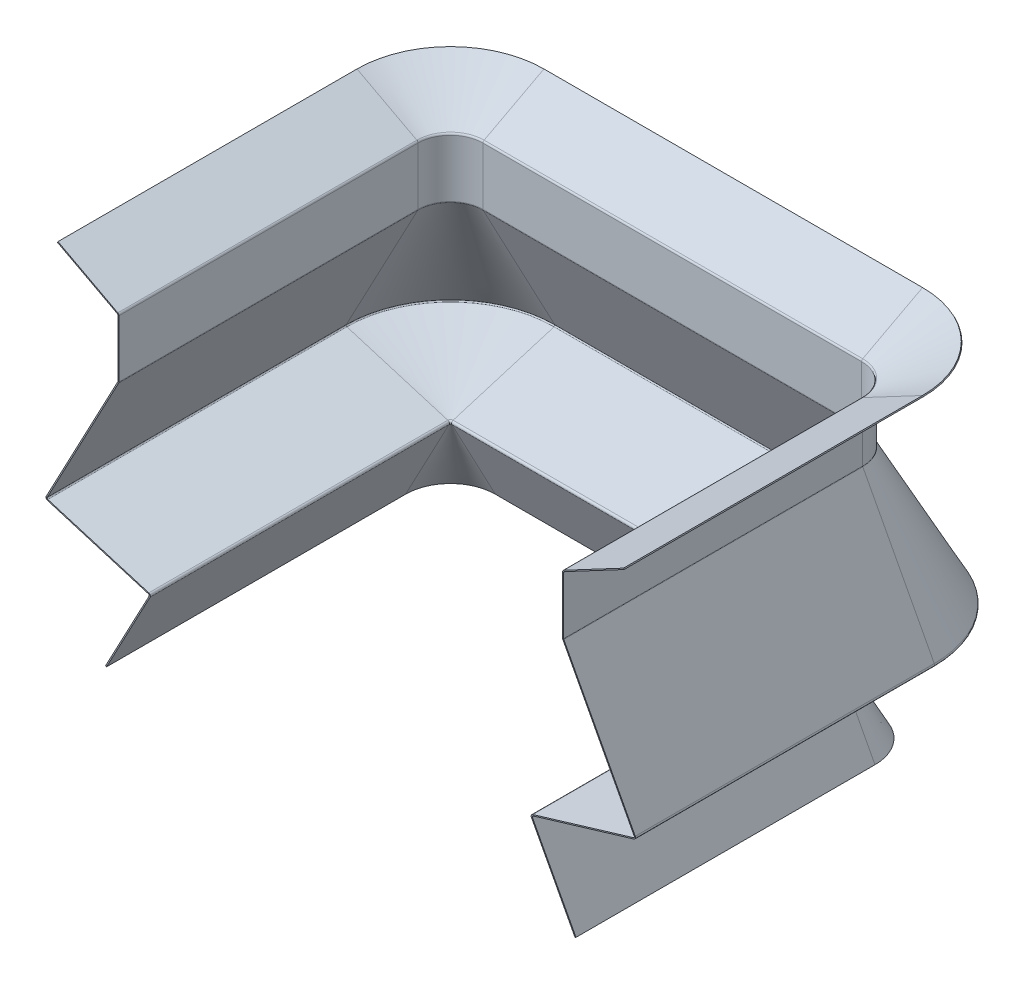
SolidWorks part; units mm, degrees
ref_plane "Front" through (0, 0, 0) normal (0, 0, 1) x (1, 0, 0)
ref_plane "Top" through (0, 0, 0) normal (0, 1, 0) x (1, 0, 0)
ref_plane "Right" through (0, 0, 0) normal (1, 0, 0) x (0, 0, -1)
sketch "Sketch1" plane through (0, 0, 0) normal (0, 1, 0) x (1, 0, 0)
  line L0 (0, 0) -> (0, 315.1479)
  line L1 (0, 315.1479) -> (429.2532, 315.1479)
  line L2 (429.2532, 315.1479) -> (429.2532, 0)
sketch "Sketch4" plane through (0, 0, 0) normal (0, 0, 1) x (1, 0, 0)
  line L0 (41.0879, 77.4332) -> (0, 0)
  line L1 (41.0879, 77.4332) -> (-54.8832, 106.3347)
  line L2 (-54.8832, 106.3347) -> (11.4271, 231.3013)
  line L3 (11.4271, 231.3013) -> (11.4271, 285.5844)
  line L4 (11.4271, 285.5844) -> (-44.4607, 315.2397)
sheet metal parameters "Sheet-Metal1" thickness 1 parameters "D1"=1.016
swept flange "Swept Flange1" thickness 1 parameters "D1"=1.016, "D2"=0, "D3"=0
other "Sweptbend1_1" parameters "D1"=0, "D4"=297.951, "D5"=1
other "Sweptbend1_2" parameters "D1"=0, "D4"=332.049, "D5"=2
other "Sweptbend1_3" parameters "D1"=0, "D4"=101.192, "D5"=3
other "Sweptbend1_4" parameters "D1"=0, "D4"=258.808, "D5"=4
other "Sweptbend2_1" parameters "D1"=0, "D4"=270, "D5"=5
other "Sweptbend2_2" parameters "D1"=0, "D4"=270, "D5"=6
flat pattern "Flat-Pattern1"
sketch "Bend-Lines1" plane through (0, 0, 0) normal (0, 1, 0) x (1, 0, 0)
sketch "Bounding-Box1" plane through (0, 0, 0) normal (0, 1, 0) x (1, 0, 0)
bend of the flat pattern "Flatten-<Sweptbend1_1>1"
bend of the flat pattern "Flatten-<Sweptbend1_2>1"
bend of the flat pattern "Flatten-<Sweptbend1_3>1"
bend of the flat pattern "Flatten-<Sweptbend1_4>1"
bend of the flat pattern "Flatten-<Sweptbend2_1>1"
bend of the flat pattern "Flatten-<Sweptbend2_2>1"
